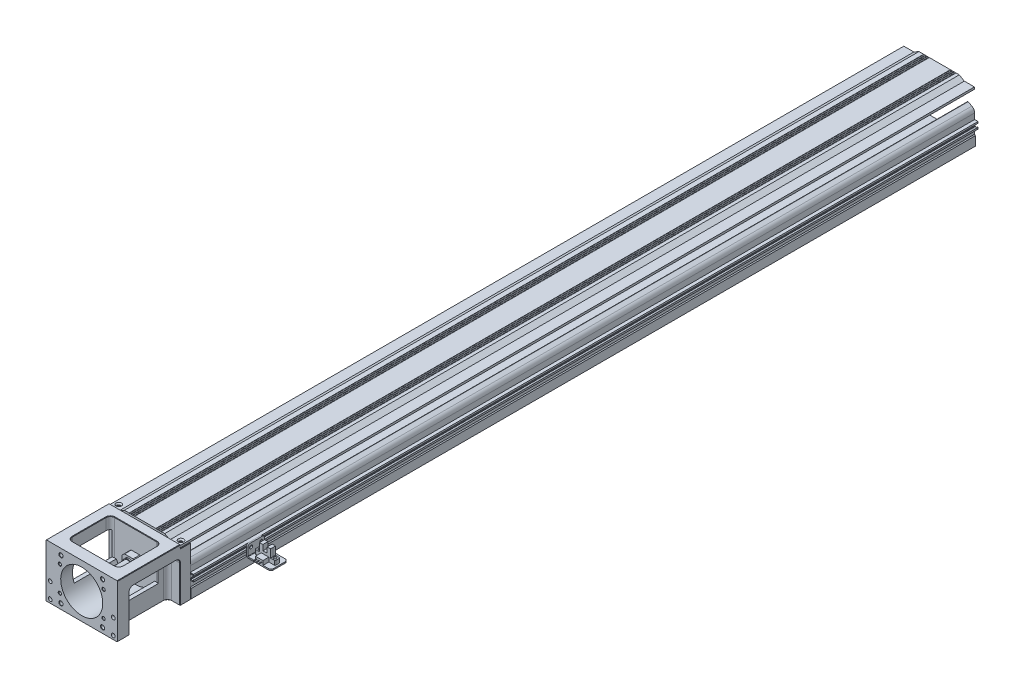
SolidWorks part; units mm, degrees
ref_plane "前视基准面" through (0, 0, 0) normal (0, 0, 1) x (1, 0, 0)
ref_plane "上视基准面" through (0, 0, 0) normal (0, 1, 0) x (1, 0, 0)
ref_plane "右视基准面" through (0, 0, 0) normal (1, 0, 0) x (0, 0, -1)
imported_body "输入1"
sketch "草图1" plane through (0, -18.6701, 0) normal (0, -1, 0) x (1, 0, 0)
  line L0 (18.0014, -145.2035) -> (18.0014, 113)
  line L1 (18.0014, 50) -> (18.0014, -240) construction
  line L2 (18.0014, 133) -> (18.0014, 70) construction
  line L3 (18.0014, 113) -> (-97.447, 113)
  line L4 (-97.447, 113) -> (-97.447, -325.1775)
  line L5 (-97.447, -325.1775) -> (60.6679, -325.1775)
  line L6 (60.6679, -325.1775) -> (60.6679, -166.0691)
  line L7 (60.6679, -166.0691) -> (18.0014, -145.2035)
  line L8 (14.5014, 133) -> (18.0014, 133) construction
  dimension "D1" = 20
extrude "切除-拉伸1" cut sketch "草图1" against normal up to surface (65.9 mm away)
sketch "草图2" plane through (0, 0, 113) normal (0, 0, -1) x (-1, 0, 0)
  line L0 (12.0486, 47.2299) -> (10.8486, 47.2299) construction
  line L1 (10.0486, 47.2299) -> (8.8486, 47.2299) construction
  line L2 (8.0486, 47.2299) -> (4.2486, 47.2299) construction
  line L3 (4.2486, 47.2299) -> (-1.7514, 43.7799) construction
  line L4 (-1.7514, 43.7799) -> (-13.7514, 43.7799) construction
  line L5 (-13.7514, 43.7799) -> (-13.7514, 41.3299) construction
  line L6 (-13.7514, 41.3299) -> (8.4486, 41.3299) construction
  line L7 (8.4486, 41.3299) -> (16.2486, 44.7799) construction
  line L8 (16.2486, 44.7799) -> (16.7111, 44.7799) construction
  line L9 (16.7111, 44.7799) -> (16.7111, 41.4207) construction
  line L10 (16.7111, 41.4207) -> (18.7111, 41.4207) construction
  line L11 (18.7111, 41.4207) -> (18.7111, 44.7799) construction
  line L12 (18.7111, 44.7799) -> (19.7111, 44.7799) construction
  line L13 (19.7111, 44.7799) -> (19.7111, 41.4207) construction
  line L14 (19.7111, 41.4207) -> (21.7111, 41.4207) construction
  line L15 (21.7111, 41.4207) -> (21.7111, 44.7799) construction
  line L16 (21.7111, 44.7799) -> (22.7486, 44.7799) construction
  line L17 (22.7486, 44.7799) -> (22.7486, 41.4026) construction
  line L18 (22.7486, 41.4026) -> (24.7486, 41.4026) construction
  line L19 (24.7486, 41.4026) -> (24.7486, 44.7799) construction
  line L20 (24.7486, 44.7799) -> (25.7486, 44.7799) construction
  line L21 (25.7486, 44.7799) -> (25.7486, 41.4026) construction
  line L22 (25.7486, 41.4026) -> (27.7486, 41.4026) construction
  line L23 (27.7486, 41.4026) -> (27.7486, 44.7799) construction
  line L24 (27.7486, 44.7799) -> (28.7486, 44.7799) construction
  line L25 (28.7486, 44.7799) -> (28.7486, 41.4026) construction
  line L26 (28.7486, 41.4026) -> (30.7486, 41.4026) construction
  line L27 (30.7486, 41.4026) -> (30.7486, 44.7799) construction
  line L28 (30.7486, 44.7799) -> (31.7486, 44.7799) construction
  line L29 (31.7486, 44.7799) -> (31.7486, 41.4026) construction
  line L30 (31.7486, 41.4026) -> (33.7486, 41.4026) construction
  line L31 (33.7486, 41.4026) -> (33.7486, 44.7799) construction
  line L32 (33.7486, 44.7799) -> (34.7862, 44.7799) construction
  line L33 (34.7862, 44.7799) -> (34.7862, 41.4207) construction
  line L34 (34.7862, 41.4207) -> (36.7862, 41.4207) construction
  line L35 (36.7862, 41.4207) -> (36.7862, 44.7799) construction
  line L36 (36.7862, 44.7799) -> (37.7862, 44.7799) construction
  line L37 (37.7862, 44.7799) -> (37.7862, 41.4207) construction
  line L38 (37.7862, 41.4207) -> (39.7862, 41.4207) construction
  line L39 (39.7862, 41.4207) -> (39.7862, 44.7799) construction
  line L40 (39.7862, 44.7799) -> (40.2486, 44.7799) construction
  line L41 (40.2486, 44.7799) -> (48.0486, 41.3299) construction
  line L42 (48.0486, 41.3299) -> (70.2486, 41.3299) construction
  line L43 (70.2486, 41.3299) -> (70.2486, 43.7799) construction
  line L44 (70.2486, 43.7799) -> (58.2486, 43.7799) construction
  line L45 (58.2486, 43.7799) -> (52.2486, 47.2299) construction
  line L46 (52.2486, 47.2299) -> (46.6486, 47.2299) construction
  line L47 (45.8486, 47.2299) -> (44.6486, 47.2299) construction
  line L48 (43.8486, 47.2299) -> (42.6486, 47.2299) construction
  line L49 (41.8486, 47.2299) -> (40.6486, 47.2299) construction
  line L50 (39.8486, 47.2299) -> (14.8486, 47.2299) construction
  line L51 (14.0486, 47.2299) -> (12.8486, 47.2299) construction
  line L52 (38.8986, -17.6701) -> (39.8986, -18.6701) construction
  line L53 (39.8986, -18.6701) -> (61.5986, -18.6701) construction
  line L54 (61.5986, -18.6701) -> (62.5986, -17.6701) construction
  line L55 (62.5986, -17.6701) -> (69.8986, -17.6701) construction
  line L56 (69.8986, -17.6701) -> (70.9986, -16.5701) construction
  line L57 (70.9986, -16.5701) -> (70.9986, -5.7701) construction
  line L58 (70.9986, -5.7701) -> (69.9986, -4.7701) construction
  line L59 (69.9986, -4.7701) -> (69.9986, 2.3299) construction
  line L60 (69.9986, 2.3299) -> (73.9986, 2.3299) construction
  line L61 (73.9986, 2.3299) -> (73.9986, 4.2299) construction
  line L62 (73.9986, 4.2299) -> (73.1986, 4.2299) construction
  line L63 (73.1986, 4.2299) -> (73.1986, 3.4299) construction
  line L64 (73.1986, 3.4299) -> (70.7986, 3.4299) construction
  line L65 (70.7986, 3.4299) -> (70.7986, 4.2299) construction
  line L66 (70.7986, 4.2299) -> (69.7986, 4.2299) construction
  line L67 (69.7986, 4.2299) -> (69.7986, 8.4299) construction
  line L68 (69.7986, 8.4299) -> (70.7986, 8.4299) construction
  line L69 (70.7986, 8.4299) -> (70.7986, 9.2299) construction
  line L70 (70.7986, 9.2299) -> (73.1986, 9.2299) construction
  line L71 (73.1986, 9.2299) -> (73.1986, 8.4299) construction
  line L72 (73.1986, 8.4299) -> (73.9986, 8.4299) construction
  line L73 (73.9986, 8.4299) -> (73.9986, 10.3299) construction
  line L74 (73.9986, 10.3299) -> (69.9986, 10.3299) construction
  line L75 (69.9986, 10.3299) -> (69.9986, 17.1217) construction
  line L76 (66.6819, 22.4883) -> (62.2222, 24.7781) construction
  line L77 (61.4986, 24.3309) -> (61.4986, 13.3299) construction
  line L78 (61.4986, 13.3299) -> (62.9986, 13.3299) construction
  line L79 (62.9986, 13.3299) -> (62.9986, -0.6701) construction
  line L80 (62.9986, -0.6701) -> (61.4986, -0.6701) construction
  line L81 (61.4986, -0.6701) -> (61.4986, -6.7701) construction
  line L82 (56.4986, -11.7701) -> (-0.5014, -11.7701) construction
  line L83 (-5.5014, -6.7701) -> (-5.512, -0.8733) construction
  line L84 (-5.512, -0.8733) -> (-7.012, -0.8733) construction
  line L85 (-7.012, -0.8733) -> (-6.9883, 13.1271) construction
  line L86 (-6.9883, 13.1271) -> (-5.4883, 13.1271) construction
  line L87 (-5.4883, 13.1271) -> (-5.5014, 24.3309) construction
  line L88 (-6.225, 24.7781) -> (-10.6846, 22.5483) construction
  line L89 (-14.0014, 17.1217) -> (-14.0014, 10.3299) construction
  line L90 (-14.0014, 10.3299) -> (-18.0014, 10.3299) construction
  line L91 (-18.0014, 10.3299) -> (-18.0014, 8.4299) construction
  line L92 (-18.0014, 8.4299) -> (-17.2014, 8.4299) construction
  line L93 (-17.2014, 8.4299) -> (-17.2014, 9.2299) construction
  line L94 (-17.2014, 9.2299) -> (-14.8014, 9.2299) construction
  line L95 (-14.8014, 9.2299) -> (-14.8014, 8.4299) construction
  line L96 (-14.8014, 8.4299) -> (-13.8014, 8.4299) construction
  line L97 (-13.8014, 8.4299) -> (-13.8014, 4.2299) construction
  line L98 (-13.8014, 4.2299) -> (-14.8014, 4.2299) construction
  line L99 (-14.8014, 4.2299) -> (-14.8014, 3.4299) construction
  line L100 (-14.8014, 3.4299) -> (-17.2014, 3.4299) construction
  line L101 (-17.2014, 3.4299) -> (-17.2014, 4.2299) construction
  line L102 (-17.2014, 4.2299) -> (-18.0014, 4.2299) construction
  line L103 (-18.0014, 4.2299) -> (-18.0014, 2.3299) construction
  line L104 (-18.0014, 2.3299) -> (-14.0014, 2.3299) construction
  line L105 (-14.0014, 2.3299) -> (-14.0014, -4.7701) construction
  line L106 (-14.0014, -4.7701) -> (-15.0014, -5.7701) construction
  line L107 (-15.0014, -5.7701) -> (-15.0014, -16.5701) construction
  line L108 (-15.0014, -16.5701) -> (-13.9014, -17.6701) construction
  line L109 (-13.9014, -17.6701) -> (-6.6014, -17.6701) construction
  line L110 (-6.6014, -17.6701) -> (-5.6014, -18.6701) construction
  line L111 (-5.6014, -18.6701) -> (16.0986, -18.6701) construction
  line L112 (16.0986, -18.6701) -> (17.0986, -17.6701) construction
  line L113 (17.0986, -17.6701) -> (38.8986, -17.6701) construction
  line L114 (12.0486, 47.2299) -> (10.8486, 47.2299)
  line L115 (10.0486, 47.2299) -> (8.8486, 47.2299)
  line L116 (8.0486, 47.2299) -> (4.2486, 47.2299)
  line L117 (4.2486, 47.2299) -> (-1.7514, 43.7799)
  line L118 (-1.7514, 43.7799) -> (-13.7514, 43.7799)
  line L119 (-13.7514, 43.7799) -> (-13.7514, 41.3299)
  line L120 (-13.7514, 41.3299) -> (8.4486, 41.3299)
  line L121 (8.4486, 41.3299) -> (16.2486, 44.7799)
  line L122 (16.2486, 44.7799) -> (16.7111, 44.7799)
  line L123 (16.7111, 44.7799) -> (16.7111, 41.4207)
  line L124 (16.7111, 41.4207) -> (18.7111, 41.4207)
  line L125 (18.7111, 41.4207) -> (18.7111, 44.7799)
  line L126 (18.7111, 44.7799) -> (19.7111, 44.7799)
  line L127 (19.7111, 44.7799) -> (19.7111, 41.4207)
  line L128 (19.7111, 41.4207) -> (21.7111, 41.4207)
  line L129 (21.7111, 41.4207) -> (21.7111, 44.7799)
  line L130 (21.7111, 44.7799) -> (22.7486, 44.7799)
  line L131 (22.7486, 44.7799) -> (22.7486, 41.4026)
  line L132 (22.7486, 41.4026) -> (24.7486, 41.4026)
  line L133 (24.7486, 41.4026) -> (24.7486, 44.7799)
  line L134 (24.7486, 44.7799) -> (25.7486, 44.7799)
  line L135 (25.7486, 44.7799) -> (25.7486, 41.4026)
  line L136 (25.7486, 41.4026) -> (27.7486, 41.4026)
  line L137 (27.7486, 41.4026) -> (27.7486, 44.7799)
  line L138 (27.7486, 44.7799) -> (28.7486, 44.7799)
  line L139 (28.7486, 44.7799) -> (28.7486, 41.4026)
  line L140 (28.7486, 41.4026) -> (30.7486, 41.4026)
  line L141 (30.7486, 41.4026) -> (30.7486, 44.7799)
  line L142 (30.7486, 44.7799) -> (31.7486, 44.7799)
  line L143 (31.7486, 44.7799) -> (31.7486, 41.4026)
  line L144 (31.7486, 41.4026) -> (33.7486, 41.4026)
  line L145 (33.7486, 41.4026) -> (33.7486, 44.7799)
  line L146 (33.7486, 44.7799) -> (34.7862, 44.7799)
  line L147 (34.7862, 44.7799) -> (34.7862, 41.4207)
  line L148 (34.7862, 41.4207) -> (36.7862, 41.4207)
  line L149 (36.7862, 41.4207) -> (36.7862, 44.7799)
  line L150 (36.7862, 44.7799) -> (37.7862, 44.7799)
  line L151 (37.7862, 44.7799) -> (37.7862, 41.4207)
  line L152 (37.7862, 41.4207) -> (39.7862, 41.4207)
  line L153 (39.7862, 41.4207) -> (39.7862, 44.7799)
  line L154 (39.7862, 44.7799) -> (40.2486, 44.7799)
  line L155 (40.2486, 44.7799) -> (48.0486, 41.3299)
  line L156 (48.0486, 41.3299) -> (70.2486, 41.3299)
  line L157 (70.2486, 41.3299) -> (70.2486, 43.7799)
  line L158 (70.2486, 43.7799) -> (58.2486, 43.7799)
  line L159 (58.2486, 43.7799) -> (52.2486, 47.2299)
  line L160 (52.2486, 47.2299) -> (46.6486, 47.2299)
  line L161 (45.8486, 47.2299) -> (44.6486, 47.2299)
  line L162 (43.8486, 47.2299) -> (42.6486, 47.2299)
  line L163 (41.8486, 47.2299) -> (40.6486, 47.2299)
  line L164 (39.8486, 47.2299) -> (14.8486, 47.2299)
  line L165 (14.0486, 47.2299) -> (12.8486, 47.2299)
  line L166 (38.8986, -17.6701) -> (39.8986, -18.6701)
  line L167 (39.8986, -18.6701) -> (61.5986, -18.6701)
  line L168 (61.5986, -18.6701) -> (62.5986, -17.6701)
  line L169 (62.5986, -17.6701) -> (69.8986, -17.6701)
  line L170 (69.8986, -17.6701) -> (70.9986, -16.5701)
  line L171 (70.9986, -16.5701) -> (70.9986, -5.7701)
  line L172 (70.9986, -5.7701) -> (69.9986, -4.7701)
  line L173 (69.9986, -4.7701) -> (69.9986, 2.3299)
  line L174 (69.9986, 2.3299) -> (73.9986, 2.3299)
  line L175 (73.9986, 2.3299) -> (73.9986, 4.2299)
  line L176 (73.9986, 4.2299) -> (73.1986, 4.2299)
  line L177 (73.1986, 4.2299) -> (73.1986, 3.4299)
  line L178 (73.1986, 3.4299) -> (70.7986, 3.4299)
  line L179 (70.7986, 3.4299) -> (70.7986, 4.2299)
  line L180 (70.7986, 4.2299) -> (69.7986, 4.2299)
  line L181 (69.7986, 4.2299) -> (69.7986, 8.4299)
  line L182 (69.7986, 8.4299) -> (70.7986, 8.4299)
  line L183 (70.7986, 8.4299) -> (70.7986, 9.2299)
  line L184 (70.7986, 9.2299) -> (73.1986, 9.2299)
  line L185 (73.1986, 9.2299) -> (73.1986, 8.4299)
  line L186 (73.1986, 8.4299) -> (73.9986, 8.4299)
  line L187 (73.9986, 8.4299) -> (73.9986, 10.3299)
  line L188 (73.9986, 10.3299) -> (69.9986, 10.3299)
  line L189 (69.9986, 10.3299) -> (69.9986, 17.1217)
  line L190 (66.6819, 22.4883) -> (62.2222, 24.7781)
  line L191 (61.4986, 24.3309) -> (61.4986, 13.3299)
  line L192 (61.4986, 13.3299) -> (62.9986, 13.3299)
  line L193 (62.9986, 13.3299) -> (62.9986, -0.6701)
  line L194 (62.9986, -0.6701) -> (61.4986, -0.6701)
  line L195 (61.4986, -0.6701) -> (61.4986, -6.7701)
  line L196 (56.4986, -11.7701) -> (-0.5014, -11.7701)
  line L197 (-5.5014, -6.7701) -> (-5.512, -0.8733)
  line L198 (-5.512, -0.8733) -> (-7.012, -0.8733)
  line L199 (-7.012, -0.8733) -> (-6.9883, 13.1271)
  line L200 (-6.9883, 13.1271) -> (-5.4883, 13.1271)
  line L201 (-5.4883, 13.1271) -> (-5.5014, 24.3309)
  line L202 (-6.225, 24.7781) -> (-10.6846, 22.5483)
  line L203 (-14.0014, 17.1217) -> (-14.0014, 10.3299)
  line L204 (-14.0014, 10.3299) -> (-18.0014, 10.3299)
  line L205 (-18.0014, 10.3299) -> (-18.0014, 8.4299)
  line L206 (-18.0014, 8.4299) -> (-17.2014, 8.4299)
  line L207 (-17.2014, 8.4299) -> (-17.2014, 9.2299)
  line L208 (-17.2014, 9.2299) -> (-14.8014, 9.2299)
  line L209 (-14.8014, 9.2299) -> (-14.8014, 8.4299)
  line L210 (-14.8014, 8.4299) -> (-13.8014, 8.4299)
  line L211 (-13.8014, 8.4299) -> (-13.8014, 4.2299)
  line L212 (-13.8014, 4.2299) -> (-14.8014, 4.2299)
  line L213 (-14.8014, 4.2299) -> (-14.8014, 3.4299)
  line L214 (-14.8014, 3.4299) -> (-17.2014, 3.4299)
  line L215 (-17.2014, 3.4299) -> (-17.2014, 4.2299)
  line L216 (-17.2014, 4.2299) -> (-18.0014, 4.2299)
  line L217 (-18.0014, 4.2299) -> (-18.0014, 2.3299)
  line L218 (-18.0014, 2.3299) -> (-14.0014, 2.3299)
  line L219 (-14.0014, 2.3299) -> (-14.0014, -4.7701)
  line L220 (-14.0014, -4.7701) -> (-15.0014, -5.7701)
  line L221 (-15.0014, -5.7701) -> (-15.0014, -16.5701)
  line L222 (-15.0014, -16.5701) -> (-13.9014, -17.6701)
  line L223 (-13.9014, -17.6701) -> (-6.6014, -17.6701)
  line L224 (-6.6014, -17.6701) -> (-5.6014, -18.6701)
  line L225 (-5.6014, -18.6701) -> (16.0986, -18.6701)
  line L226 (16.0986, -18.6701) -> (17.0986, -17.6701)
  line L227 (17.0986, -17.6701) -> (38.8986, -17.6701)
  arc A0 (12.0486, 47.2299) -> (12.8486, 47.2299) centre (12.4486, 47.2299) ccw construction
  arc A1 (10.0486, 47.2299) -> (10.8486, 47.2299) centre (10.4486, 47.2299) ccw construction
  arc A2 (8.0486, 47.2299) -> (8.8486, 47.2299) centre (8.4486, 47.2299) ccw construction
  arc A3 (45.8486, 47.2299) -> (46.6486, 47.2299) centre (46.2486, 47.2299) ccw construction
  arc A4 (43.8486, 47.2299) -> (44.6486, 47.2299) centre (44.2486, 47.2299) ccw construction
  arc A5 (41.8486, 47.2299) -> (42.6486, 47.2299) centre (42.2486, 47.2299) ccw construction
  arc A6 (39.8486, 47.2299) -> (40.6486, 47.2299) centre (40.2486, 47.2299) ccw construction
  arc A7 (14.0486, 47.2299) -> (14.8486, 47.2299) centre (14.4486, 47.2299) ccw construction
  circle A8 centre (27.9986, 13.3299) radius 8 construction
  arc A9 (69.9986, 17.1217) -> (66.6819, 22.4883) centre (63.9986, 17.1217) ccw construction
  arc A10 (62.2222, 24.7781) -> (61.4986, 24.3309) centre (61.9986, 24.3309) ccw construction
  arc A11 (56.4986, -11.7701) -> (61.4986, -6.7701) centre (56.4986, -6.7701) ccw construction
  arc A12 (-5.5014, -6.7701) -> (-0.5014, -11.7701) centre (-0.5014, -6.7701) ccw construction
  arc A13 (-5.5014, 24.3309) -> (-6.225, 24.7781) centre (-6.0014, 24.3309) ccw construction
  arc A14 (-10.6846, 22.5483) -> (-14.0014, 17.1217) centre (-7.911, 17.1262) ccw construction
  arc A15 (12.0486, 47.2299) -> (12.8486, 47.2299) centre (12.4486, 47.2299) ccw
  arc A16 (10.0486, 47.2299) -> (10.8486, 47.2299) centre (10.4486, 47.2299) ccw
  arc A17 (8.0486, 47.2299) -> (8.8486, 47.2299) centre (8.4486, 47.2299) ccw
  arc A18 (45.8486, 47.2299) -> (46.6486, 47.2299) centre (46.2486, 47.2299) ccw
  arc A19 (43.8486, 47.2299) -> (44.6486, 47.2299) centre (44.2486, 47.2299) ccw
  arc A20 (41.8486, 47.2299) -> (42.6486, 47.2299) centre (42.2486, 47.2299) ccw
  arc A21 (39.8486, 47.2299) -> (40.6486, 47.2299) centre (40.2486, 47.2299) ccw
  arc A22 (14.0486, 47.2299) -> (14.8486, 47.2299) centre (14.4486, 47.2299) ccw
  circle A23 centre (27.9986, 13.3299) radius 8
  arc A24 (69.9986, 17.1217) -> (66.6819, 22.4883) centre (63.9986, 17.1217) ccw
  arc A25 (62.2222, 24.7781) -> (61.4986, 24.3309) centre (61.9986, 24.3309) ccw
  arc A26 (56.4986, -11.7701) -> (61.4986, -6.7701) centre (56.4986, -6.7701) ccw
  arc A27 (-5.5014, -6.7701) -> (-0.5014, -11.7701) centre (-0.5014, -6.7701) ccw
  arc A28 (-5.5014, 24.3309) -> (-6.225, 24.7781) centre (-6.0014, 24.3309) ccw
  arc A29 (-10.6846, 22.5483) -> (-14.0014, 17.1217) centre (-7.911, 17.1262) ccw
extrude "凸台-拉伸1" add sketch "草图2" along normal blind 913
hole_wizard "打孔尺寸(%根据)内六角圆柱头螺钉的类型1" positions "草图3" profile "草图4" counterbore size "M6" standard "GB"
sketch "草图3" plane through (0, -11.7701, 0) normal (0, 1, 0) x (1, 0, 0)
  line L0 (-27.3486, 800) -> (-27.3486, 253.986) construction
  line L1 (-39.8486, 800) -> (-14.8486, 800) construction
  line L2 (-73.9986, -133) -> (-70.4986, -133) construction
  point P0 (-50.3486, -63)
  point P8 (-4.3486, -63)
  point P11 (-50.3486, 37)
  point P13 (-50.3486, 137)
  point P15 (-50.3486, 237)
  point P17 (-50.3486, 337)
  point P19 (-50.3486, 437)
  point P21 (-50.3486, 537)
  point P24 (-4.3486, 537)
  point P25 (-4.3486, 437)
  point P26 (-4.3486, 337)
  point P27 (-4.3486, 237)
  point P28 (-4.3486, 137)
  point P29 (-4.3486, 37)
  point P30 (-50.3486, 637)
  point P32 (-50.3486, 737)
  point P34 (-50.3486, 837)
  point P36 (-50.3486, 937)
  point P39 (-4.3486, 937)
  point P40 (-4.3486, 837)
  point P41 (-4.3486, 737)
  point P42 (-4.3486, 637)
  dimension "D1" = 46
  dimension "D2" = 70
  dimension "D3" = 100
  dimension "D4" = 100
  dimension "D5" = 100
  dimension "D6" = 100
  dimension "D7" = 100
  dimension "D8" = 100
  dimension "D9" = 100
  dimension "D10" = 100
  dimension "D11" = 100
  dimension "D12" = 100
sketch "草图4" plane through (-50.3486, -11.7701, 63) normal (1, 0, 0) x (0, 0, 1)
  line L0 (0, 0) -> (0, 6.9)
  line L1 (0, 6.9) -> (3.3, 6.9)
  line L3 (3.3, 6.9) -> (3.3, 4)
  line L4 (3.3, 4) -> (5.5, 4)
  line L5 (5.5, 4) -> (5.5, 0)
  line L7 (5.5, 0) -> (0, 0)
  line L11 (0, -6.35) -> (0, 107.95) construction
  dimension "通孔孔直径" = 6.6
  dimension "通孔孔深度" = 6.9
  dimension "柱形沉头孔直径" = 11
  dimension "柱形沉头孔深度" = 4
